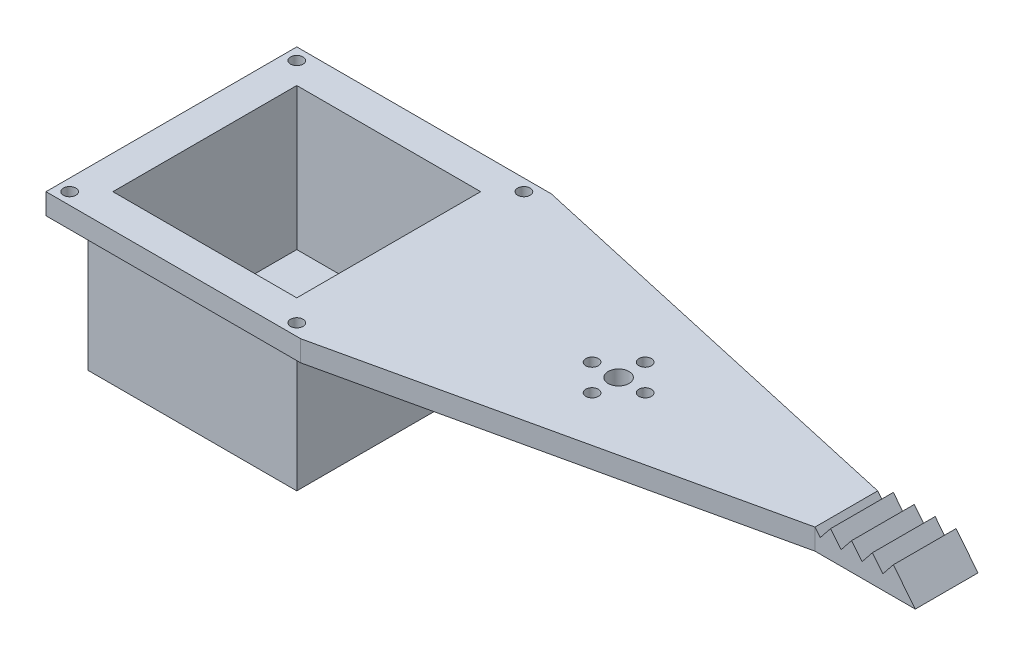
SolidWorks part; units mm, degrees
ref_plane "Front Plane" through (0, 0, 0) normal (0, 0, 1) x (1, 0, 0)
ref_plane "Top Plane" through (0, 0, 0) normal (0, 1, 0) x (1, 0, 0)
ref_plane "Right Plane" through (0, 0, 0) normal (1, 0, 0) x (0, 0, -1)
body saved out of another part "Stock-ARMPT1-1"
